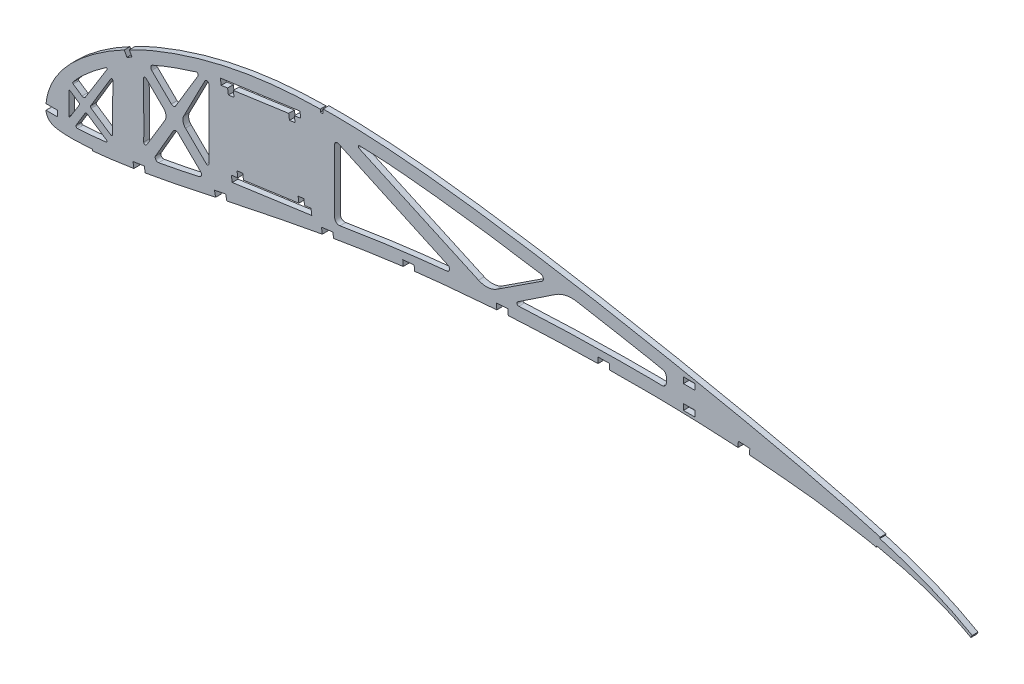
SolidWorks part; units mm, degrees
ref_plane "Front Plane" through (0, 0, 0) normal (0, 0, 1) x (1, 0, 0)
ref_plane "Top Plane" through (0, 0, 0) normal (0, 1, 0) x (1, 0, 0)
ref_plane "Right Plane" through (0, 0, 0) normal (1, 0, 0) x (0, 0, -1)
sketch "Model" plane through (0, 0, 0) normal (0, 0, 1) x (1, 0, 0)
  line L0 (44.1173, 61.6433) -> (45.6082, 58.8391)
  line L1 (45.6082, 58.8391) -> (48.4143, 60.3325)
  line L2 (48.4143, 60.3325) -> (46.9209, 63.1328)
  line L3 (154.1526, 87.5767) -> (154.1526, 88.3704)
  line L4 (0.896, 14.2875) -> (7.1909, 14.2875)
  line L5 (7.1909, 14.2875) -> (7.1909, 11.1125)
  line L6 (7.1909, 11.1125) -> (0.8411, 11.1125)
  line L7 (26.4381, 5.2846) -> (26.4381, 4.4908)
  line L8 (97.2948, 74.7662) -> (97.7544, 71.4985)
  line L9 (141.7701, 77.6834) -> (141.3104, 80.9536)
  line L10 (141.3104, 80.9536) -> (97.2948, 74.7662)
  line L11 (460.0905, 31.4325) -> (460.2554, 32.2089)
  line L12 (462.3283, 37.3101) -> (462.117, 36.545)
  line L13 (512.4999, 14.2988) -> (513.2599, 15.6926)
  line L14 (353.4509, 56.4304) -> (359.9282, 56.4304)
  line L15 (359.9282, 56.4304) -> (359.9282, 59.7337)
  line L16 (359.9282, 59.7337) -> (353.4509, 59.7337)
  line L17 (353.4509, 59.7337) -> (353.4509, 56.4304)
  line L18 (353.4509, 43.6022) -> (359.9282, 43.6022)
  line L19 (359.9282, 43.6022) -> (359.9282, 46.9054)
  line L20 (359.9282, 46.9054) -> (353.4509, 46.9054)
  line L21 (353.4509, 46.9054) -> (353.4509, 43.6022)
  line L22 (84.9303, 69.5794) -> (72.6029, 49.0902)
  line L23 (77.2038, 46.7685) -> (88.7433, 69.137)
  line L24 (77.9734, 41.1164) -> (89.5286, 29.7763)
  line L25 (86.37, 24.4674) -> (73.8859, 36.7252)
  line L26 (66.5846, 39.087) -> (56.5495, 22.4078)
  line L27 (61.4516, 19.5176) -> (71.186, 36.358)
  line L28 (59.3058, 59.4365) -> (70.1646, 48.7799)
  line L29 (65.8862, 44.58) -> (56.2951, 53.9974)
  line L30 (36.7342, 44.1621) -> (25.5705, 25.6676)
  line L31 (22.6558, 28.2992) -> (34.6424, 47.5913)
  line L32 (25.8323, 24.4881) -> (36.5968, 17.2673)
  line L33 (34.2904, 13.588) -> (23.7894, 20.6442)
  line L34 (15.8798, 31.1642) -> (20.7593, 27.891)
  line L35 (13.9967, 14.3626) -> (19.2726, 22.854)
  line L36 (19.0654, 23.8185) -> (14.1172, 27.1435)
  line L37 (22.3452, 20.3243) -> (17.5063, 12.3079)
  line L38 (90.9625, 68.6578) -> (90.9625, 30.4233)
  line L39 (174.3653, 80.8491) -> (182.7093, 80.5474)
  line L40 (174.0308, 79.4316) -> (240.0979, 49.3477)
  line L41 (250.3621, 50.1284) -> (275.1818, 66.3587)
  line L42 (162.692, 75.9841) -> (223.1795, 48.1038)
  line L43 (261.7866, 49.8207) -> (282.7096, 63.7551)
  line L52 (97.7544, 71.4985) -> (101.2916, 71.9955)
  line L53 (101.2916, 71.9955) -> (101.7273, 68.8505)
  line L54 (141.7701, 77.6834) -> (138.233, 77.1863)
  line L55 (138.233, 77.1863) -> (138.6526, 74.0392)
  line L56 (138.6526, 74.0392) -> (135.5085, 73.5972)
  line L57 (135.5085, 73.5972) -> (135.0888, 76.7445)
  line L58 (104.4357, 72.4373) -> (104.8765, 69.293)
  line L59 (104.8765, 69.293) -> (101.7273, 68.8505)
  line L60 (104.4357, 72.4373) -> (135.0888, 76.7445)
  line L61 (147.8806, 34.2051) -> (147.421, 37.4729)
  line L62 (103.4053, 31.288) -> (103.865, 28.0177)
  line L63 (103.865, 28.0177) -> (147.8806, 34.2051)
  line L64 (147.421, 37.4729) -> (143.8838, 36.9759)
  line L65 (143.8838, 36.9759) -> (143.4481, 40.1208)
  line L66 (103.4053, 31.288) -> (106.9424, 31.785)
  line L67 (106.9424, 31.785) -> (106.5228, 34.9322)
  line L68 (106.5228, 34.9322) -> (109.6669, 35.3742)
  line L69 (109.6669, 35.3742) -> (110.0866, 32.2268)
  line L70 (140.7397, 36.5341) -> (140.2989, 39.6783)
  line L71 (140.2989, 39.6783) -> (143.4481, 40.1208)
  line L72 (140.7397, 36.5341) -> (110.0866, 32.2268)
  line L73 (100.8705, 17.6272) -> (100.2309, 20.7008)
  line L74 (100.2309, 20.7008) -> (94.0112, 19.421)
  line L75 (94.0112, 19.421) -> (94.6712, 16.3166)
  line L76 (153.2528, 31.2778) -> (159.5485, 32.1065)
  line L77 (159.5485, 32.1065) -> (159.927, 29.231)
  line L78 (153.6671, 28.1299) -> (153.2528, 31.2778)
  line L79 (48.9664, 10.6225) -> (55.2423, 11.5897)
  line L80 (55.2423, 11.5897) -> (55.7146, 8.5249)
  line L81 (49.45, 7.4846) -> (48.9664, 10.6225)
  line L82 (198.1839, 38.2243) -> (204.5104, 38.7703)
  line L83 (204.5104, 38.7703) -> (204.7572, 35.911)
  line L84 (198.4569, 35.0611) -> (198.1839, 38.2243)
  line L85 (250.0328, 43.3301) -> (256.3692, 43.7466)
  line L86 (256.3692, 43.7466) -> (256.5774, 40.5785)
  line L87 (250.2411, 40.1619) -> (250.0328, 43.3301)
  line L88 (306.1532, 45.5744) -> (312.5021, 45.6933)
  line L89 (312.5021, 45.6933) -> (312.5615, 42.5188)
  line L90 (306.2126, 42.3999) -> (306.1532, 45.5744)
  line L91 (383.8507, 44.1122) -> (390.1897, 43.7397)
  line L92 (390.1897, 43.7397) -> (390.0035, 40.5701)
  line L93 (383.6644, 40.9426) -> (383.8507, 44.1122)
  line L110 (154.1526, 87.5767) -> (154.1526, 85.9892)
  line L111 (154.1526, 85.9892) -> (152.5651, 85.9892)
  line L112 (152.5651, 85.9892) -> (152.5651, 87.5245)
  arc A0 (90.9625, 68.6578) -> (88.7433, 69.137) centre (89.7908, 68.6098) ccw
  arc A1 (84.9303, 69.5794) -> (83.8395, 70.9804) centre (84.1151, 70.0699) ccw
  arc A2 (59.8058, 62.1794) -> (59.3058, 59.4365) centre (60.4854, 60.6384) ccw
  arc A3 (56.2951, 53.9974) -> (54.7232, 53.3404) centre (55.6475, 53.3379) ccw
  arc A4 (70.1646, 48.7799) -> (72.6029, 49.0902) centre (71.2613, 49.8974) ccw
  arc A5 (77.2038, 46.7685) -> (77.9734, 41.1164) centre (81.234, 44.4388) ccw
  arc A6 (66.5846, 39.087) -> (65.8862, 44.58) centre (62.755, 41.3911) ccw
  arc A7 (73.8859, 36.7252) -> (71.186, 36.358) centre (72.6783, 35.4953) ccw
  arc A8 (85.5712, 21.7011) -> (86.37, 24.4674) centre (85.2237, 23.2999) ccw
  arc A9 (61.4516, 19.5176) -> (63.1354, 17.138) centre (62.8404, 18.7148) ccw
  arc A10 (54.8946, 22.8912) -> (56.5495, 22.4078) centre (55.7857, 22.8673) ccw
  arc A11 (89.5286, 29.7763) -> (90.9625, 30.4233) centre (90.1038, 30.414) ccw
  arc A12 (15.7411, 32.0936) -> (15.8798, 31.1642) centre (16.234, 31.6921) ccw
  arc A13 (34.6424, 47.5913) -> (34.1505, 48.1542) centre (34.3105, 47.7976) ccw
  arc A14 (37.7817, 43.8706) -> (36.7342, 44.1621) centre (37.2174, 43.8705) ccw
  arc A15 (36.5968, 17.2673) -> (37.7338, 17.8872) centre (37.0036, 17.8738) ccw
  arc A16 (25.5705, 25.6676) -> (25.8323, 24.4881) centre (26.32, 25.2151) ccw
  arc A17 (23.7894, 20.6442) -> (22.3452, 20.3243) centre (23.2197, 19.7964) ccw
  arc A18 (34.0271, 12.4761) -> (34.2904, 13.588) centre (33.9501, 13.0815) ccw
  arc A19 (17.5063, 12.3079) -> (18.2236, 11.0816) centre (18.1987, 11.8899) ccw
  arc A20 (13.495, 14.5028) -> (13.9967, 14.3626) centre (13.7663, 14.5057) ccw
  arc A21 (14.1172, 27.1435) -> (13.5402, 26.8222) centre (13.9105, 26.8359) ccw
  arc A22 (19.2726, 22.854) -> (19.0654, 23.8185) centre (18.6692, 23.2289) ccw
  arc A23 (20.7593, 27.891) -> (22.6558, 28.2992) centre (21.5105, 29.0108) ccw
  arc A24 (174.3653, 80.8491) -> (174.0308, 79.4316) centre (174.3385, 80.1072) ccw
  arc A25 (162.692, 75.9841) -> (160.5174, 74.5901) centre (162.0503, 74.5919) ccw
  arc A26 (222.6514, 44.9688) -> (223.1795, 48.1038) centre (222.49, 46.608) ccw
  arc A27 (240.0979, 49.3477) -> (250.3621, 50.1284) centre (244.5208, 59.0609) ccw
  arc A28 (275.1818, 66.3587) -> (274.4881, 69.6198) centre (274.2034, 67.8549) ccw
  arc A29 (294.567, 66.2616) -> (282.7096, 63.7551) centre (291.7834, 50.1304) ccw
  arc A30 (261.7866, 49.8207) -> (262.3948, 47.9936) centre (262.3398, 48.99) ccw
  spline S0 degree 3 poles (0.896, 14.2875) (0.9474, 14.8567) (1.0775, 16.2996) (1.9736, 20.7423) (4.337, 26.9153) (9.1403, 34.3863) (15.191, 41.2282) (23.2065, 48.3434) (31.7831, 54.4675) (39.0735, 58.9403) (42.922, 61.0027) (44.1173, 61.6433) knots 0 0 0 0 0.025762 0.065304 0.204051 0.320575 0.464326 0.61454 0.803095 0.938846 1 1 1 1
  spline S1 degree 3 poles (46.9209, 63.1328) (47.8229, 63.5926) (54.5867, 67.0407) (67.0012, 72.2395) (85.9994, 78.5438) (103.5946, 82.7846) (120.343, 85.4558) (134.4927, 86.8488) (145.2752, 87.4309) (151.3458, 87.5088) (152.5651, 87.5245) knots 0 0 0 0 0.027777 0.208276 0.368417 0.576647 0.70392 0.833447 0.966548 1 1 1 1
  spline S2 degree 3 poles (154.1526, 88.3704) (155.7316, 88.3859) (160.7381, 88.4349) (169.2781, 88.3111) (178.0432, 87.9894) (188.982, 87.378) (200.2762, 86.5279) (215.8064, 84.9791) (229.9218, 83.3343) (246.6093, 81.1208) (263.9124, 78.5837) (283.8608, 75.3955) (304.3201, 71.8699) (322.8235, 68.501) (341.6188, 64.9209) (360.5489, 61.1851) (381.6867, 56.8428) (402.3031, 52.4149) (422.0225, 47.9288) (438.6563, 43.8113) (451.971, 40.3052) (459.066, 38.2534) (462.3283, 37.3101) knots 0 0 0 0 0.015131 0.047975 0.081829 0.099168 0.152954 0.19034 0.248714 0.289116 0.35164 0.416281 0.482687 0.550571 0.596496 0.666024 0.735458 0.803269 0.868077 0.929231 0.967461 1 1 1 1
  spline S3 degree 3 poles (0.8411, 11.1125) (0.8634, 10.89) (0.9096, 10.4296) (1.0698, 9.7471) (1.3011, 9.0774) (1.7083, 8.2341) (2.2924, 7.4802) (3.0098, 6.8392) (3.6334, 6.4002) (4.3453, 6.0454) (5.1223, 5.733) (6.2832, 5.4039) (7.8748, 5.0966) (9.9433, 4.8978) (12.2036, 4.7564) (14.674, 4.6844) (17.3841, 4.7085) (20.9757, 4.8606) (24.0266, 5.0597) (26.082, 5.2514) (26.4381, 5.2846) knots 0 0 0 0 0.023329 0.048267 0.072979 0.097172 0.14579 0.171203 0.19749 0.225123 0.254045 0.284812 0.350946 0.422956 0.501604 0.58738 0.680902 0.784489 0.962658 1 1 1 1
  spline S4 degree 3 poles (26.4381, 4.4908) (27.43, 4.5843) (29.1502, 4.7463) (31.6503, 5.0109) (34.0009, 5.2854) (36.5208, 5.5962) (39.2645, 5.9628) (42.1073, 6.3677) (45.6846, 6.8989) (46.8876, 7.0753) (49.1957, 7.4439) (49.45, 7.4846) knots 0 0 0 0 0.117674 0.204054 0.296972 0.397031 0.504573 0.621231 0.74748 0.884171 0.901098 0.901098 0.901098 0.901098
  spline S5 degree 3 poles (159.927, 29.231) (164.609, 30.0266) (177.5252, 32.2213) (192.1161, 34.2048) (198.4569, 35.0611) knots 0.005843 0.005843 0.005843 0.005843 0.281642 0.766677 0.766677 0.766677 0.766677
  spline S6 degree 3 poles (460.2554, 32.2089) (461.6179, 31.9242) (464.592, 31.3027) (469.1038, 30.2557) (473.7492, 29.1171) (479.6218, 27.5609) (485.2704, 25.8996) (490.6812, 24.076) (494.5394, 22.6746) (499.4584, 20.7215) (504.1855, 18.5841) (507.7098, 16.887) (508.8738, 16.2653) (508.9246, 16.2382) knots 0 0 0 0 0.081265 0.177386 0.270397 0.360504 0.532077 0.614019 0.693834 0.771712 0.922956 0.996639 1 1 1 1
  spline S7 degree 3 poles (462.117, 36.545) (463.9951, 35.9837) (467.4265, 34.9582) (473.7689, 32.9451) (482.1719, 30.0815) (494.7855, 25.2189) (505.4175, 20.0526) (512.0726, 16.3526) (513.2599, 15.6926) knots 0 0 0 0 0.106235 0.194091 0.360618 0.587308 0.92638 1 1 1 1
  spline S8 degree 3 poles (508.9246, 16.2382) (509.5681, 15.8984) (510.7671, 15.2652) (511.9513, 14.6048) (512.4999, 14.2988) knots 0 0 0 0 0.536727 1 1 1 1
  spline S9 degree 3 poles (33.791, 47.9822) (32.715, 47.2346) (29.3327, 44.8639) (23.0786, 39.8911) (18.0884, 34.9455) (15.8713, 32.2535) (15.7411, 32.0936) knots 0 0 0 0 0.148044 0.546566 0.97327 1 1 1 1
  spline S10 degree 3 poles (13.5402, 26.8222) (13.6957, 22.635) (13.4478, 18.9427) (13.495, 14.5028) knots 0 0 0 0 1 1 1 1
  spline S11 degree 3 poles (18.2236, 11.0816) (20.4533, 11.1505) (25.1562, 11.4905) (30.6021, 12.0475) (33.5182, 12.4113) (34.0271, 12.4761) knots 0 0 0 0 0.417537 0.901822 1 1 1 1
  spline S12 degree 3 poles (37.7338, 17.8872) (37.7034, 19.5406) (37.8733, 25.1763) (37.7624, 33.1191) (37.7818, 40.315) (37.7818, 43.195) (37.7817, 43.8706) knots 0 0 0 0 0.189757 0.650835 0.921057 1 1 1 1
  spline S13 degree 3 poles (59.8058, 62.1794) (60.736, 62.5896) (65.3488, 64.5886) (73.4798, 67.6561) (80.776, 70.0534) (83.8395, 70.9804) knots 0 0 0 0 0.12162 0.618319 1 1 1 1
  spline S14 degree 3 poles (85.5712, 21.7011) (84.8748, 21.5497) (77.3505, 19.7564) (70.2982, 18.4781) (63.1354, 17.138) knots 0 0 0 0 0.091868 1 1 1 1
  spline S15 degree 3 poles (54.8946, 22.8912) (55.1664, 33.0536) (54.6937, 42.5076) (54.7232, 53.3404) knots 0 0 0 0 1 1 1 1
  spline S16 degree 3 poles (34.1505, 48.1542) (34.0326, 48.1013) (33.9133, 48.0433) (33.791, 47.9822) knots 0 0 0 0 1 1 1 1
  spline S17 degree 3 poles (182.7093, 80.5474) (189.1998, 80.3127) (203.9122, 79.0319) (224.7058, 76.788) (247.0387, 73.8352) (262.9521, 71.4636) (272.7205, 69.9049) (274.4881, 69.6198) knots 0 0 0 0 0.211108 0.478099 0.678937 0.941891 1 1 1 1
  spline S18 degree 3 poles (342.6178, 57.301) (342.8556, 57.1564) (343.3196, 56.8558) (343.9224, 55.998) (344.0548, 54.3191) (344.0635, 53.1323) (344.0046, 52.1372) knots 0 0 0 0 0.133796 0.311607 0.520839 1 1 1 1
  spline S19 degree 3 poles (344.0046, 52.1372) (343.9898, 51.9205) (343.9644, 51.6198) (343.7412, 50.8975) (343.1437, 50.0944) (342.1892, 49.6378) (340.5847, 49.5466) (331.3564, 49.9695) (318.7827, 49.6814) (295.9304, 49.427) (278.6425, 48.8419) (264.8756, 48.1305) (262.3948, 47.9936) knots 0 0 0 0 0.007133 0.011727 0.026841 0.041958 0.048068 0.084734 0.375473 0.502003 0.910258 1 1 1 1
  spline S20 degree 3 poles (163.4716, 37.0471) (162.9775, 37.0316) (162.2979, 37.0365) (161.2999, 37.6156) (160.5495, 38.5748) (160.4922, 40.2822) (160.6043, 52.3301) (160.5308, 63.0229) (160.5174, 74.5901) knots 0 0 0 0 0.033942 0.053074 0.084704 0.121132 0.178193 1 1 1 1
  spline S21 degree 3 poles (294.567, 66.2616) (301.1466, 65.1262) (312.0757, 63.185) (326.3911, 60.4978) (336.1035, 58.7251) (340.871, 57.6826) (342.6178, 57.301) knots 0 0 0 0 0.409182 0.680103 0.900255 1 1 1 1
  spline S22 degree 3 poles (222.6514, 44.9688) (219.4299, 44.6517) (203.1624, 42.9557) (182.7534, 40.2195) (167.3011, 37.6814) (163.4716, 37.0471) knots 0 0 0 0 0.162997 0.822694 1 1 1 1
  spline S23 degree 3 poles (55.7146, 8.5249) (59.2151, 9.1491) (68.5159, 10.8078) (79.9581, 13.198) (89.1667, 15.1386) (92.7916, 15.9143) (94.6712, 16.3166) knots 0.913792 0.913792 0.913792 0.913792 1.019423 1.194459 1.559413 1.952426 1.952426 1.952426 1.952426
  spline S24 degree 3 poles (100.8705, 17.6272) (118.4281, 21.3321) (136.0051, 24.9646) (153.6671, 28.1299) knots 0.09525 0.09525 0.09525 0.09525 0.904456 0.904456 0.904456 0.904456
  spline S25 degree 3 poles (204.7572, 35.911) (207.1883, 36.2385) (211.5049, 36.8201) (240.3271, 39.3981) (248.5635, 40.0388) (250.2411, 40.1619) knots 0.84271 0.84271 0.84271 0.84271 1.815502 2.569989 2.796713 2.796713 2.796713 2.796713
  spline S26 degree 3 poles (256.5774, 40.5785) (258.1947, 40.6587) (261.4364, 40.8196) (280.7995, 41.8516) (299.5018, 42.2681) (306.2126, 42.3999) knots 2.81286 2.81286 2.81286 2.81286 3.584254 4.35903 4.978472 4.978472 4.978472 4.978472
  spline S27 degree 3 poles (312.5615, 42.5188) (322.7303, 42.5788) (342.7215, 42.6966) (352.2746, 42.1944) (358.11, 42.2477) (377.8584, 41.2631) (383.6644, 40.9426) knots 5.389052 5.389052 5.389052 5.389052 6.221305 7.025212 7.816697 8.314762 8.314762 8.314762 8.314762
  spline S28 degree 3 poles (390.0035, 40.5701) (393.6961, 40.3082) (401.1716, 39.7779) (424.5319, 37.271) (425.8467, 37.2477) (454.2765, 32.8115) (457.9345, 31.9443) (460.0905, 31.4325) knots 8.375363 8.375363 8.375363 8.375363 9.097405 9.837068 10.547646 11.002273 11.654977 11.654977 11.654977 11.654977
extrude "Boss-Extrude7" add sketch "Model" along normal blind 3.175
